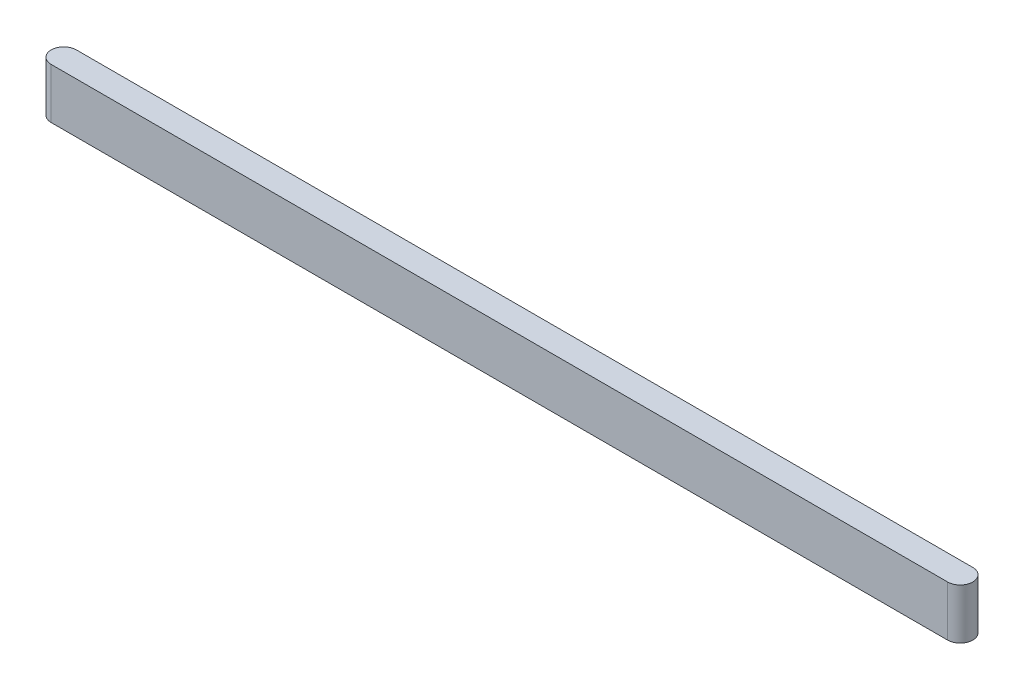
SolidWorks part; units mm, degrees
ref_plane "Plan1" through (0, 0, 0) normal (0, 0, 1) x (1, 0, 0)
ref_plane "Plan2" through (0, 0, 0) normal (0, 1, 0) x (1, 0, 0)
ref_plane "Plan3" through (0, 0, 0) normal (1, 0, 0) x (0, 0, -1)
sketch "Esquisse1" plane through (0, 0, 0) normal (1, 0, 0) x (0, 0, -1)
  line L1 (-5, 0) -> (5, 0)
  line L2 (-5, 0) -> (-5, -20)
  line L3 (-5, -20) -> (5, -20)
  line L4 (5, 0) -> (5, -20)
  dimension "D1" = 10
  dimension "D2" = 20
extrude "Base-Extrusion" add sketch "Esquisse1" along normal mid plane 356
sketch "Esquisse2" plane through (0, 0, 0) normal (0, 1, 0) x (-1, 0, 0)
  line L0 (-178, -5) -> (-178, 5) construction
  line L1 (178, -5) -> (178, 5) construction
  circle A0 centre (-178, 0) radius 5
  circle A1 centre (178, 0) radius 5
  dimension "D1" = 10
  dimension "D2" = 10
extrude "Boss.-Extru.1" add sketch "Esquisse2" against normal blind 20
